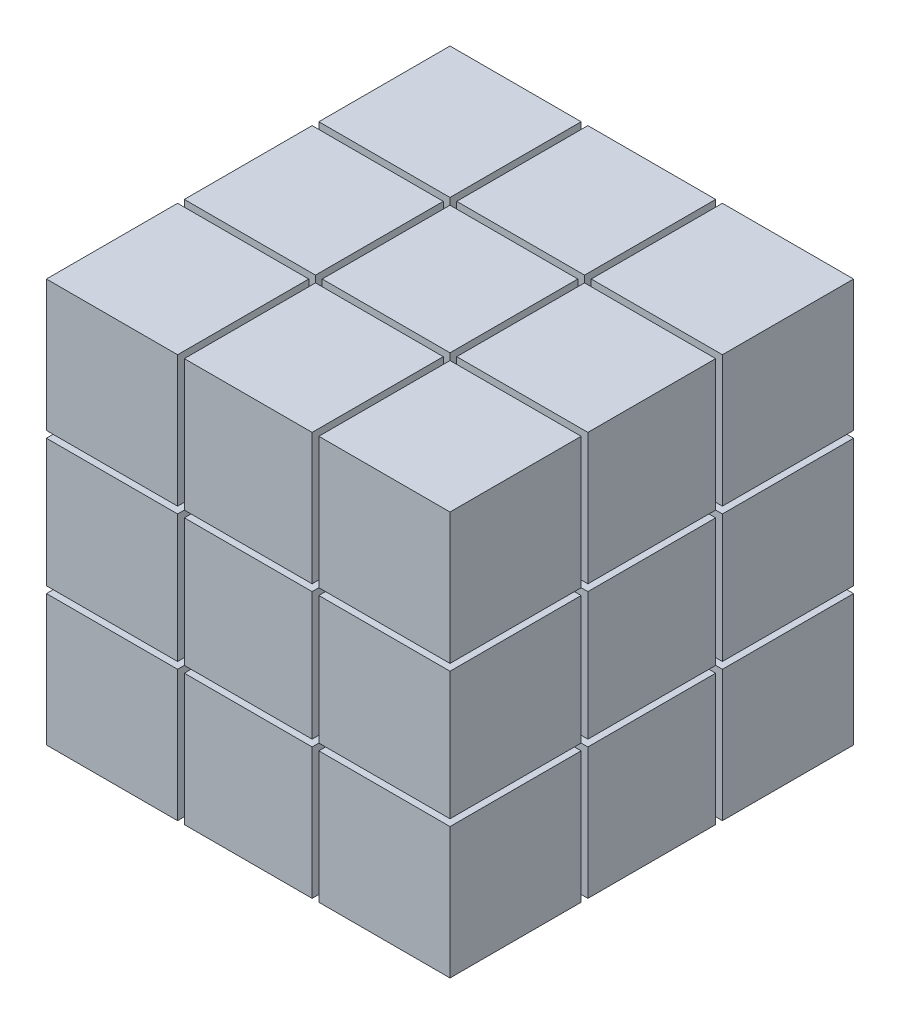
SolidWorks part; units mm, degrees
ref_plane "Front Plane" through (0, 0, 0) normal (0, 0, 1) x (1, 0, 0)
ref_plane "Top Plane" through (0, 0, 0) normal (0, 1, 0) x (1, 0, 0)
ref_plane "Right Plane" through (0, 0, 0) normal (1, 0, 0) x (0, 0, -1)
sketch "Sketch1" plane through (0, 0, 0) normal (0, 1, 0) x (1, 0, 0)
  line L1 (30, 30) -> (-30, 30)
  line L2 (30, 30) -> (30, -30)
  line L3 (30, -30) -> (-30, -30)
  line L4 (-30, 30) -> (-30, -30)
  line L5 (30, 30) -> (-30, -30) construction
  line L6 (30, -30) -> (-30, 30) construction
  point P0 (0, 0)
  dimension "D1" = 60
  dimension "D2" = 60
extrude "Boss-Extrude2" add sketch "Sketch1" along normal blind 60 contours L3 L4 L1 L2
sketch "Sketch3" plane through (0, 60, 0) normal (0, 1, 0) x (1, 0, 0)
  line L0 (-10, 36.3982) -> (-10, -35.3013)
  line L1 (-30, 30) -> (-30, -30) construction
  line L2 (10, 39.3984) -> (10, -40.3459)
  line L3 (-45.3201, 10) -> (38.8637, 10)
  line L4 (-53.6893, -10) -> (42.4215, -10)
  line L5 (30, -30) -> (-30, -30) construction
  line L6 (30, 30) -> (-30, 30) construction
  dimension "D1" = 20
  dimension "D2" = 20
  dimension "D3" = 20
  dimension "D4" = 20
extrude "Cut-Extrude-Thin1" cut sketch "Sketch3" against normal blind 60 thin
sketch "Sketch4" plane through (30, 0, 0) normal (1, 0, 0) x (0, 0, -1)
  line L0 (-36.0782, 20) -> (33.6248, 20)
  line L1 (-33.6858, 40) -> (32.1546, 40)
  line L2 (-10.5, 0) -> (-30, 0) construction
  line L3 (-10.5, 60) -> (-30, 60) construction
  dimension "D1" = 20
  dimension "D2" = 20
extrude "Cut-Extrude-Thin2" cut sketch "Sketch4" against normal blind 60 thin
